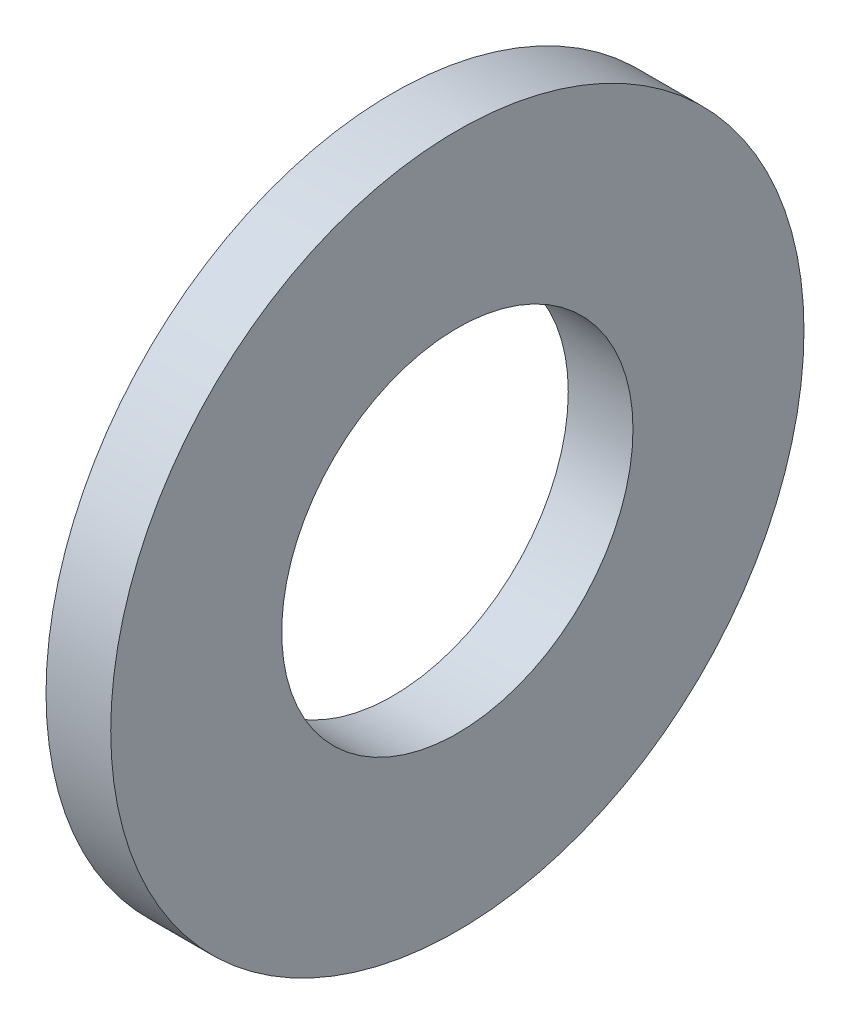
SolidWorks part; units mm, degrees
ref_plane "Front Plane" through (0, 0, 0) normal (0, 0, 1) x (1, 0, 0)
ref_plane "Top Plane" through (0, 0, 0) normal (0, 1, 0) x (1, 0, 0)
ref_plane "Right Plane" through (0, 0, 0) normal (1, 0, 0) x (0, 0, -1)
sketch "Sketch1" plane through (0, 0, 0) normal (1, 0, 0) x (0, 0, -1)
  circle A0 centre (0, 0) radius 4.826
  circle A1 centre (0, 0) radius 9.525
  dimension "OD" = 9.652
  dimension "ID" = 19.05
extrude "Boss-Extrude1" add sketch "Sketch1" along normal blind 1.778
